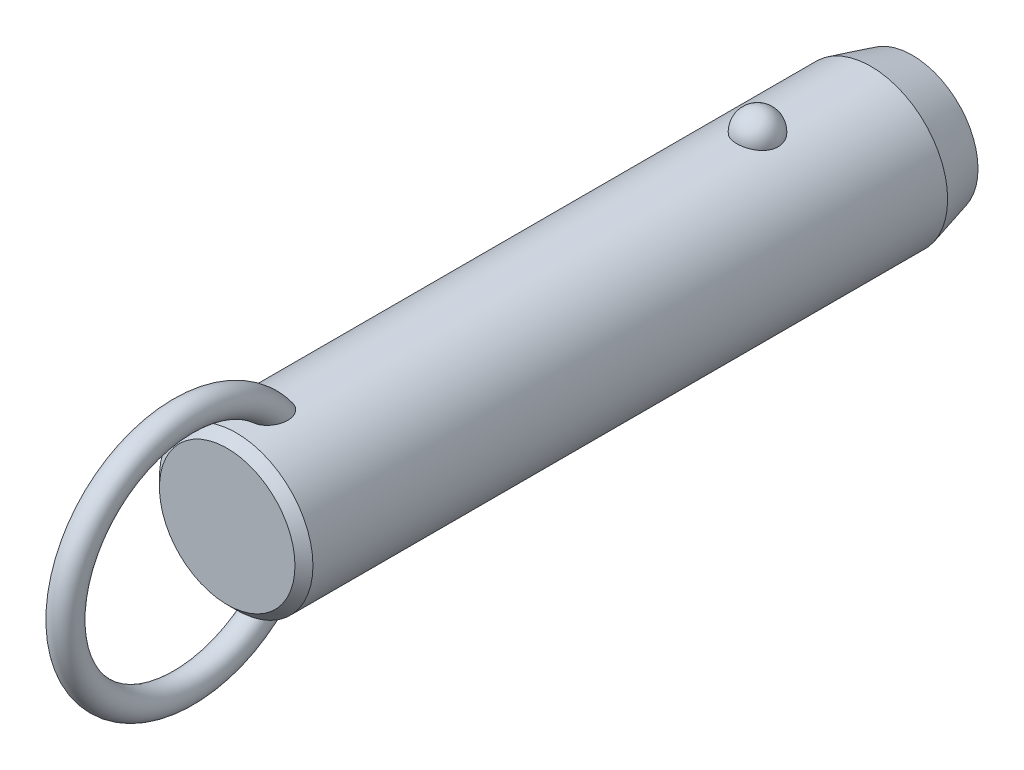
SolidWorks part; units mm, degrees
ref_plane "Front Plane" through (0, 0, 0) normal (0, 0, 1) x (1, 0, 0)
ref_plane "Top Plane" through (0, 0, 0) normal (0, 1, 0) x (1, 0, 0)
ref_plane "Right Plane" through (0, 0, 0) normal (1, 0, 0) x (0, 0, -1)
sketch "Sketch2" plane through (0, 0, 0) normal (0, 0, 1) x (1, 0, 0)
  circle A0 centre (0, 0) radius 11.1
  point P3 (0, 11.1)
  dimension "D1" = 22.2
extrude "Boss-Extrude1" add sketch "Sketch2" along normal blind 61
sketch "Sketch3" plane through (0, 0, 0) normal (0, 0, -1) x (-1, 0, 0)
  circle A0 centre (0, 0) radius 11.1
  dimension "D1" = 22.2
extrude "Boss-Extrude2" add sketch "Sketch3" along normal blind 25.4
chamfer "Chamfer1" distance 6 angle 15 1 edges at (-11.1, 0, -25.4)
sketch "Sketch12" plane through (0, 0, 0) normal (1, 0, 0) x (0, 0, -1)
  line L0 (-61, 11.1) -> (-61, -11.1) construction
  point P0 (-61, 0)
sketch "Sketch13" plane through (0, 0, 0) normal (1, 0, 0) x (0, 0, -1)
  circle A0 centre (-80.05, 0) radius 19.05
  point P2 (-61, 0)
  dimension "D1" = 38.1
sketch "Sketch14" plane through (0, 0, 0) normal (0, 1, 0) x (1, 0, 0)
  circle A0 centre (0, -63) radius 2
  point P2 (0, -61)
  dimension "D1" = 4
sweep "Sweep1" add profiles "Sketch14" path "Sketch13"
sketch "Sketch15" plane through (0, 0, 61) normal (0, 0, 1) x (1, 0, 0)
  circle A0 centre (0, 0) radius 11.1
  dimension "D1" = 22.2
extrude "Boss-Extrude3" add sketch "Sketch15" along normal blind 12.7
chamfer "Chamfer2" distance 1.3 angle 45 1 edges at (11.1, 0, 73.7)
sketch "Sketch18" plane through (0, 0, 0) normal (1, 0, 0) x (0, 0, -1)
  line L0 (19.4, 11.1) -> (-64.568, 11.1) construction
  line L1 (3, 14.1) -> (3, 8.1)
  line L2 (-64.568, -11.1) -> (19.4, -11.1) construction
  arc A0 (3, 14.1) -> (3, 8.1) centre (3, 11.1) ccw
  point P4 (0, 11.1)
  dimension "D1" = 25.2
revolve "Revolve1" add sketch "Sketch18" angle 360 about L1
